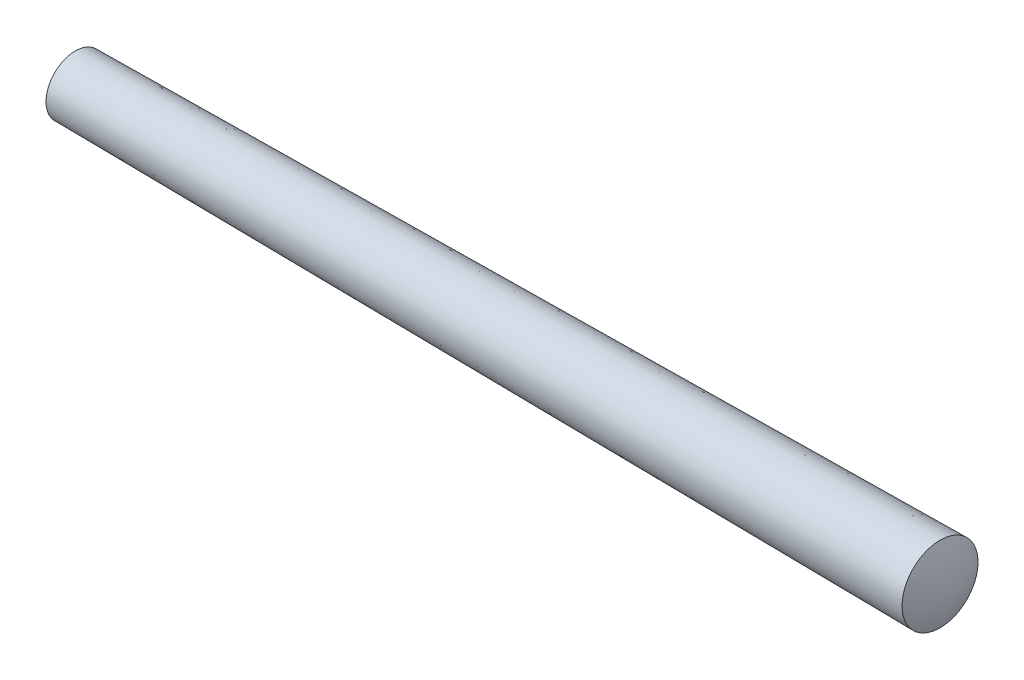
SolidWorks part; units mm, degrees
ref_plane "Plane1" through (0, 0, 0) normal (0, 0, 1) x (1, 0, 0)
ref_plane "Plane2" through (0, 0, 0) normal (0, 1, 0) x (1, 0, 0)
ref_plane "Plane3" through (0, 0, 0) normal (1, 0, 0) x (0, 0, -1)
other "Configuration Table"
sketch "Sketch1" plane through (0, 0, 0) normal (0, 0, 1) x (1, 0, 0)
  line L0 (0, 0) -> (210, 0) construction
  line L2 (0.4, 1.5) -> (44.6, 1.942)
  line L4 (0, 0) -> (45, 0)
  line L5 (0.4, -1.5) -> (44.6, -1.942) construction
  arc A0 (0.4, 1.5) -> (0, 0) centre (3.0125, 0) ccw
  arc A1 (44.6, 1.942) -> (45, 0) centre (40.0858, 0) cw
revolve "Base-Revolve" add sketch "Sketch1" angle 360 about L0
equation "\"D1@Sketch1\" = \"Crown_ht@Sketch1\""
